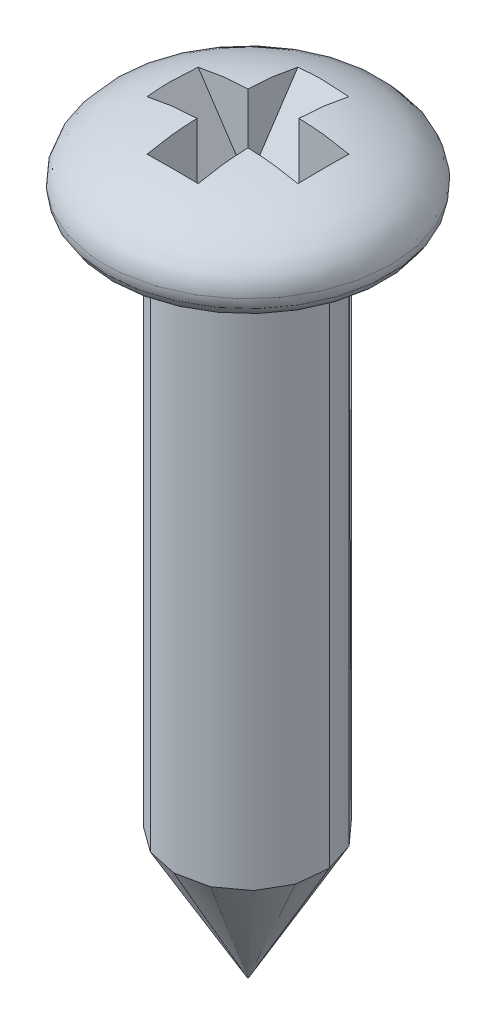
SolidWorks part; units mm, degrees
ref_plane "Plan de face" through (0, 0, 0) normal (0, 0, 1) x (1, 0, 0)
ref_plane "Plan de dessus" through (0, 0, 0) normal (0, 1, 0) x (1, 0, 0)
ref_plane "Plan de droite" through (0, 0, 0) normal (1, 0, 0) x (0, 0, -1)
ref_plane "Plan3" through (0, 6.4, 0) normal (0, 1, 0) x (-1, 0, 0)
sketch "Esquisse1" plane through (0, 6.4, 0) normal (0, 1, 0) x (-1, 0, 0)
  circle A0 centre (0, 0) radius 1.45
extrude "Extrusion1" add sketch "Esquisse1" against normal blind 13
sketch "Esquisse2" plane through (0, 0, 0) normal (0, 0, 1) x (1, 0, 0)
  line L0 (-3.5764, 6.4) -> (3.9855, 6.4) construction
  line L1 (0, 8.9067) -> (0, 4.7448) construction
  line L2 (-2.6992, 8) -> (4.0303, 8) construction
  line L3 (-2.8, 8.6386) -> (-2.8, 5.3938) construction
  line L4 (0, 6.4) -> (-2.3, 6.4)
  line L5 (0, 8) -> (0, 6.4)
  arc A0 (-2.3, 6.4) -> (-2.8, 6.9001) centre (-2.3, 6.9) cw
  spline S0 degree 3 poles (-2.8, 6.9001) (-2.802, 7.3106) (-1.7042, 7.9956) (-0.6729, 7.9983) (0, 8) knots 0 0 0 0 0.347597 1 1 1 1
  point P15 (-2.8, 6.4)
  point P18 (-2.8, 8)
  point P21 (0, 6.4)
  dimension "D1" = 0.5
revolve "Révolution1" add sketch "Esquisse2" angle 360 about L1
sketch "Esquisse3" plane through (0, 0, 0) normal (0, 0, 1) x (1, 0, 0)
  line L0 (0, 9.9885) -> (0, 5.1977) construction
  line L1 (-3.3122, 6.4) -> (4.0377, 6.4) construction
  line L2 (-3.6691, 0) -> (6.2564, 0) construction
  line L3 (-1.5, 8.9361) -> (-1.5, 5.7428) construction
  line L4 (-0.5, 7.218) -> (-0.5, 5.7428) construction
  line L5 (0, 8.589) -> (-1.5, 8.3981)
  line L6 (-2.5295, 7.9) -> (1.4809, 7.9) construction
  line L7 (-1.5, 8.3981) -> (-1.5, 7.9)
  line L8 (-1.5, 7.9) -> (-0.5, 6.4)
  line L9 (-0.5, 6.4) -> (0.5, 6.4)
  line L10 (1.5, 7.9) -> (0.5, 6.4)
  line L11 (1.5, 8.3981) -> (1.5, 7.9)
  line L12 (0, 8.589) -> (1.5, 8.3981)
  point P19 (0, 6.4)
extrude "Enlèv. mat.-Extru.1" cut sketch "Esquisse3" against normal mid plane 1
pattern_circular "Répétition circulaire1" count 2 every 90 about axis through (0, 0, 0) along (0, 1, 0) of "Enlèv. mat.-Extru.1"
chamfer "Chanfrein1" distance 1.44 distance2 2.5 1 edges at (0, -6.6, 1.45)
